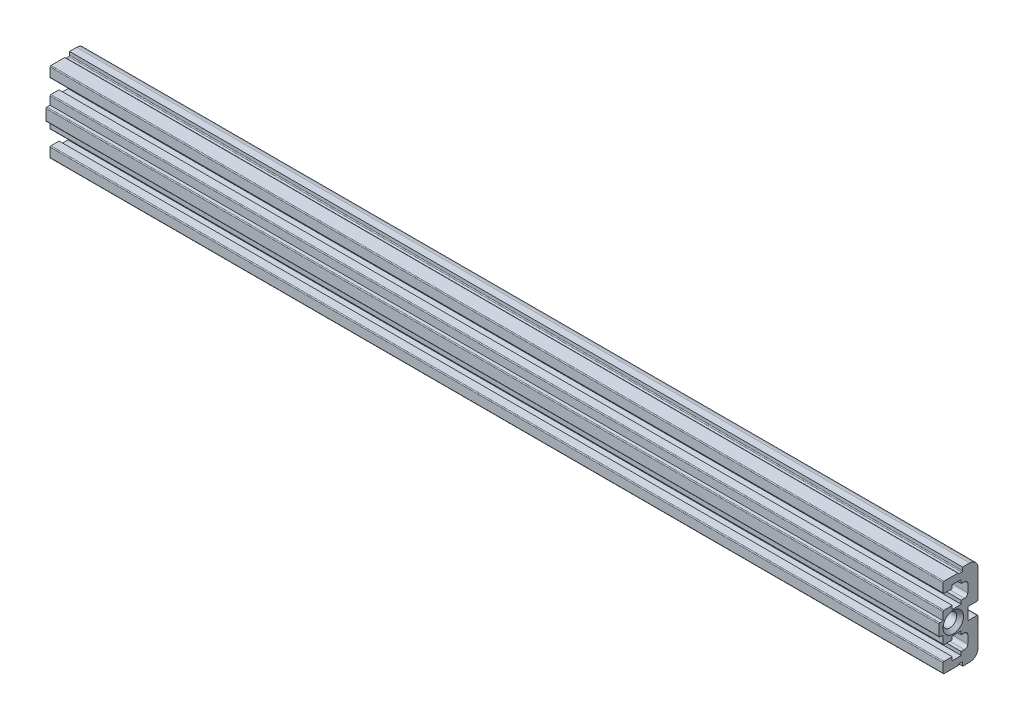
SolidWorks part; units mm, degrees
other "1"
ref_plane "前视基准面" through (0, 0, 0) normal (0, 0, 1) x (1, 0, 0)
ref_plane "上视基准面" through (0, 0, 0) normal (0, 1, 0) x (1, 0, 0)
ref_plane "右视基准面" through (0, 0, 0) normal (1, 0, 0) x (0, 0, -1)
imported_body "输入1"
sketch "草图1" plane through (0, 0, 8.75) normal (0, 0, -1) x (-1, 0, 0)
  line L0 (-215.9, -8.2) -> (-215.9, -1.4) construction
  line L1 (215.9, 5.0674) -> (2.54, 5.0674)
  line L2 (215.9, 5.0674) -> (215.9, -25.3677)
  line L3 (215.9, -25.3677) -> (2.54, -25.3677)
  line L4 (2.54, 5.0674) -> (2.54, -25.3677)
  line L5 (215.9, -1.4) -> (215.9, -8.2) construction
  dimension "D1" = 218.44
extrude "切除-拉伸1" cut sketch "草图1" against normal through all
sketch "草图2" plane through (-2.54, 0, 0) normal (-1, 0, 0) x (0, 0, 1)
  circle A0 centre (14.8, -9.9) radius 1.65
extrude "切除-拉伸2" cut sketch "草图2" against normal blind 15.02
chamfer "倒角1" distance 0.85 angle 45 1 edges at (-2.54, -9.9, 16.45)
